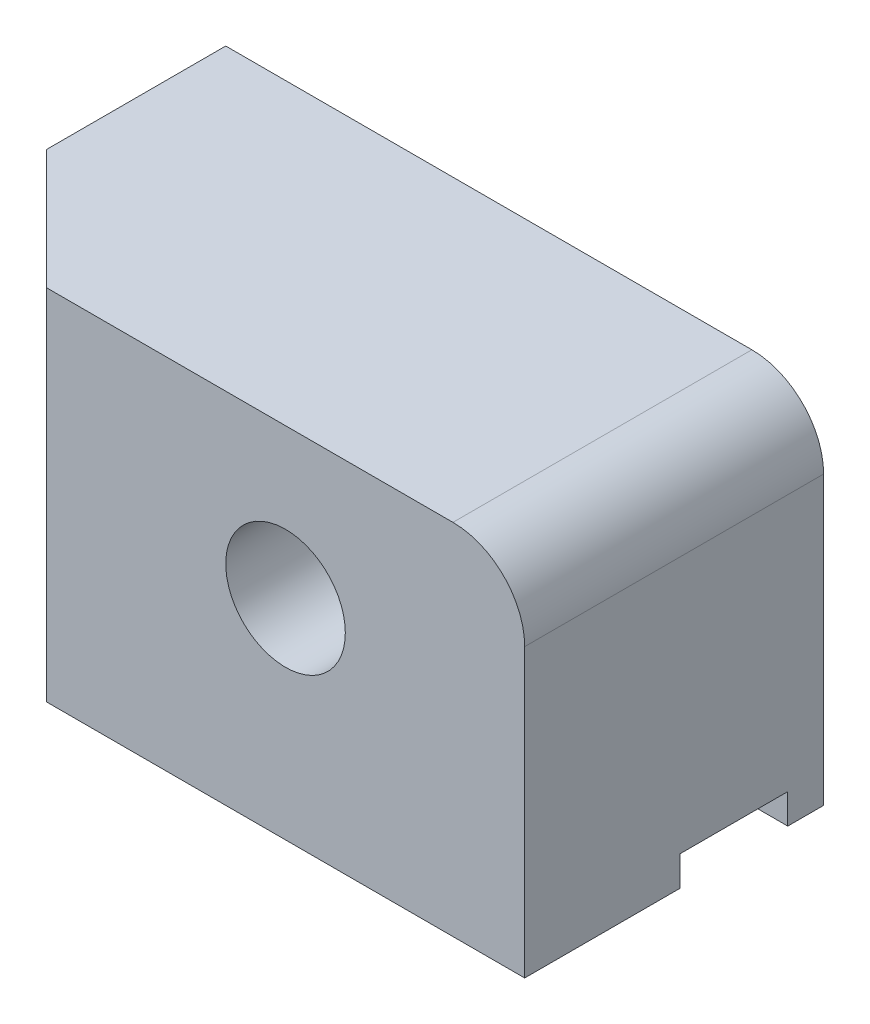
SolidWorks part; units mm, degrees
ref_plane "正面" through (0, 0, 0) normal (0, 0, 1) x (1, 0, 0)
ref_plane "平面" through (0, 0, 0) normal (0, 1, 0) x (1, 0, 0)
ref_plane "右側面" through (0, 0, 0) normal (1, 0, 0) x (0, 0, -1)
sketch "ｽｹｯﾁ1" plane through (0, 0, 0) normal (0, 0, 1) x (1, 0, 0)
  line L1 (0, 0) -> (100, 0)
  line L2 (0, 0) -> (0, 60)
  line L3 (0, 60) -> (100, 60)
  line L4 (100, 0) -> (100, 60)
  dimension "D1" = 100
  dimension "D2" = 60
extrude "押し出し1" add sketch "ｽｹｯﾁ1" along normal blind 50
sketch "ｽｹｯﾁ2" plane through (0, 0, 50) normal (0, 0, 1) x (1, 0, 0)
  line L0 (0, 0) -> (100, 0) construction
  line L1 (0, 60) -> (0, 0) construction
  circle A0 centre (60, 35) radius 10
  dimension "D1" = 20
  dimension "D2" = 35
  dimension "D3" = 60
extrude "ｶｯﾄ - 押し出し1" cut sketch "ｽｹｯﾁ2" against normal through all
sketch "ｽｹｯﾁ3" plane through (100, 0, 0) normal (1, 0, 0) x (0, 0, -1)
  line L0 (-50, 0) -> (0, 0) construction
  line L1 (-6, 0) -> (-24, 0)
  line L2 (-6, 0) -> (-6, 5)
  line L3 (-6, 5) -> (-24, 5)
  line L4 (-24, 0) -> (-24, 5)
  line L5 (0, 0) -> (0, 60) construction
  dimension "D1" = 18
  dimension "D2" = 6
  dimension "D3" = 5
extrude "ｶｯﾄ - 押し出し2" cut sketch "ｽｹｯﾁ3" against normal through all
fillet "ﾌｨﾚｯﾄ1" radius 12 1 edges at (100, 60, 25)
chamfer "面取り1" distance 20 angle 45 1 edges at (0, 30, 50)
